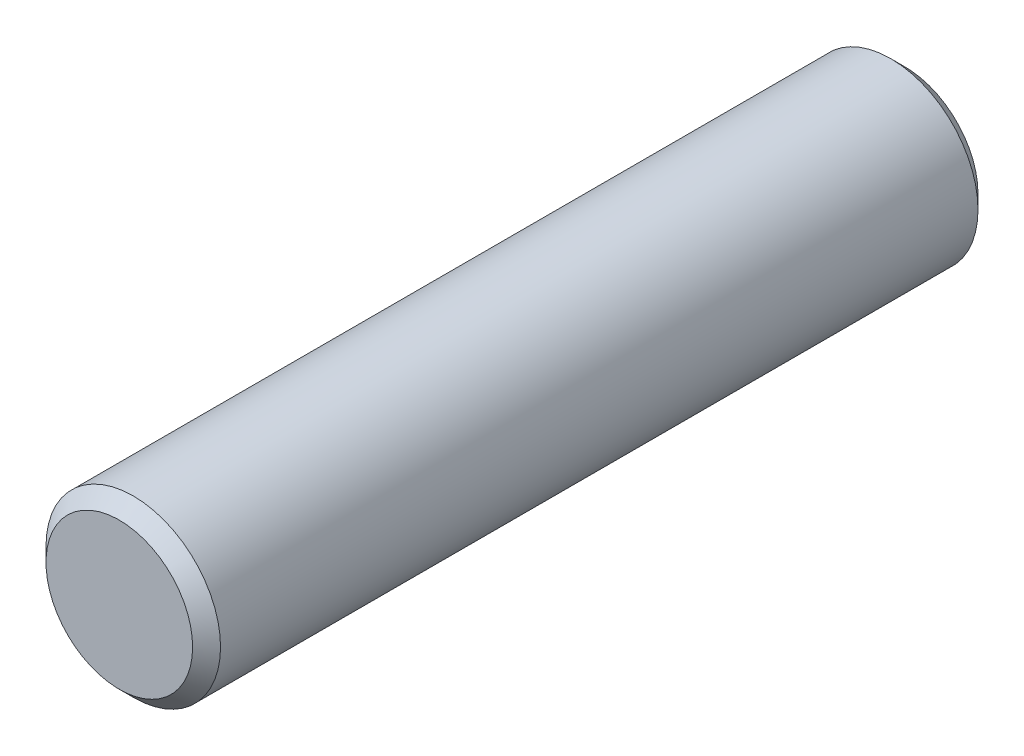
SolidWorks part; units mm, degrees
ref_plane "Спереди" through (0, 0, 0) normal (0, 0, 1) x (1, 0, 0)
ref_plane "Сверху" through (0, 0, 0) normal (0, 1, 0) x (1, 0, 0)
ref_plane "Справа" through (0, 0, 0) normal (1, 0, 0) x (0, 0, -1)
sketch "Эскиз1" plane through (0, 0, 0) normal (1, 0, 0) x (0, 0, -1)
  line L0 (-32.2743, 0) -> (33.3465, 0) construction
  line L1 (-6.8898, 1.5875) -> (-7.1438, 1.3335)
  line L2 (7.1438, 0) -> (-7.1438, 0)
  line L3 (7.1438, 0) -> (7.1438, 1.3335)
  line L4 (6.8898, 1.5875) -> (-6.8898, 1.5875)
  line L5 (-7.1438, 0) -> (-7.1438, 1.3335)
  line L6 (7.1438, 1.3335) -> (6.8898, 1.5875)
  point P4 (-7.1438, 1.5875)
  point P5 (7.1438, 1.5875)
  dimension "D1" = 14.2875
  dimension "D2" = 3.175
revolve "Повернуть1" add sketch "Эскиз1" angle 360 about L0
